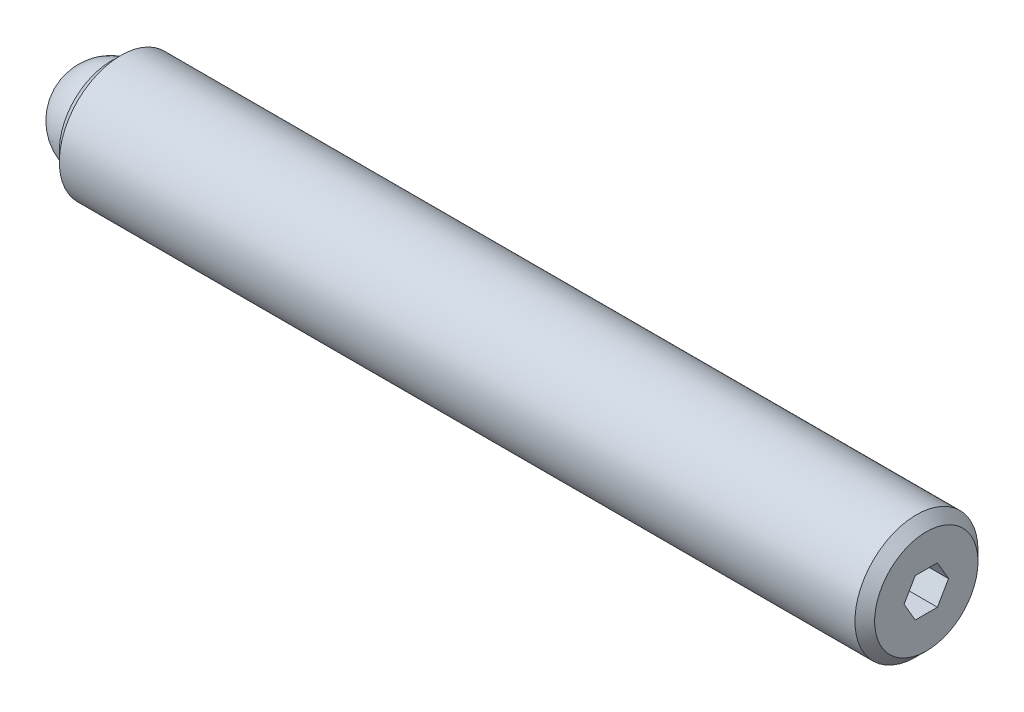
SolidWorks part; units mm, degrees
ref_plane "Front Plane" through (0, 0, 0) normal (0, 0, 1) x (1, 0, 0)
ref_plane "Top Plane" through (0, 0, 0) normal (0, 1, 0) x (1, 0, 0)
ref_plane "Right Plane" through (0, 0, 0) normal (1, 0, 0) x (0, 0, -1)
sketch "Sketch2" plane through (0, 0, 0) normal (1, 0, 0) x (0, 0, -1)
  circle A0 centre (0, 0) radius 3.175
  dimension "D1" = 6.35
extrude "Boss-Extrude1" add sketch "Sketch2" along normal blind 42.0688
sketch "Sketch3" plane through (0, 0, 0) normal (-1, 0, 0) x (0, 0, 1)
  circle A0 centre (0, 0) radius 2.3813
  dimension "D1" = 4.7625
chamfer "Chamfer1" distance 0.508 angle 45 1 edges at (0, 0, -3.175)
chamfer "Chamfer2" distance 0.508 angle 45 1 edges at (42.0688, 0, -3.175)
sketch "Sketch4" plane through (42.0688, 0, 0) normal (1, 0, 0) x (0, 0, -1)
  line L1 (1.1457, 0) -> (0.5728, 0.9922)
  line L2 (0.5728, 0.9922) -> (-0.5728, 0.9922)
  line L3 (-0.5728, 0.9922) -> (-1.1457, 0)
  line L4 (-1.1457, 0) -> (-0.5728, -0.9922)
  line L5 (-0.5728, -0.9922) -> (0.5728, -0.9922)
  line L6 (0.5728, -0.9922) -> (1.1457, 0)
  circle A0 centre (0, 0) radius 0.9922 construction
  dimension "D1" = 1.9844
extrude "Cut-Extrude2" cut sketch "Sketch4" against normal blind 2.286
extrude "Cut-Extrude3" cut sketch "Sketch3" against normal blind 2.3813
sketch "Sketch5" plane through (0, 0, 0) normal (-1, 0, 0) x (0, 0, 1)
  line L0 (0, 0) -> (0, -2.3813)
  line L1 (0, 0) -> (0, 2.3813)
  arc A0 (0, 2.3813) -> (0, -2.3813) centre (0, 0) ccw
  dimension "D1" = 2.3813
revolve "Revolve1" add sketch "Sketch5" angle 360 about L1
sketch "Sketch7" plane through (0, 0, 0) normal (-1, 0, 0) x (0, 0, 1)
  line L0 (0, 0) -> (0, 2.3813) construction
  circle A0 centre (0, 0) radius 2.3813 construction
  arc A1 (0.0635, 2.3804) -> (-0.0635, 2.3804) centre (0, 0) ccw
  arc A2 (0.0635, 2.3804) -> (-0.0635, 2.3804) centre (0, 2.3813) ccw
  dimension "D1" = 0.127
extrude "Cut-Extrude4" cut sketch "Sketch7" against normal up to surface (2.3813 mm away) contours A2 A1
